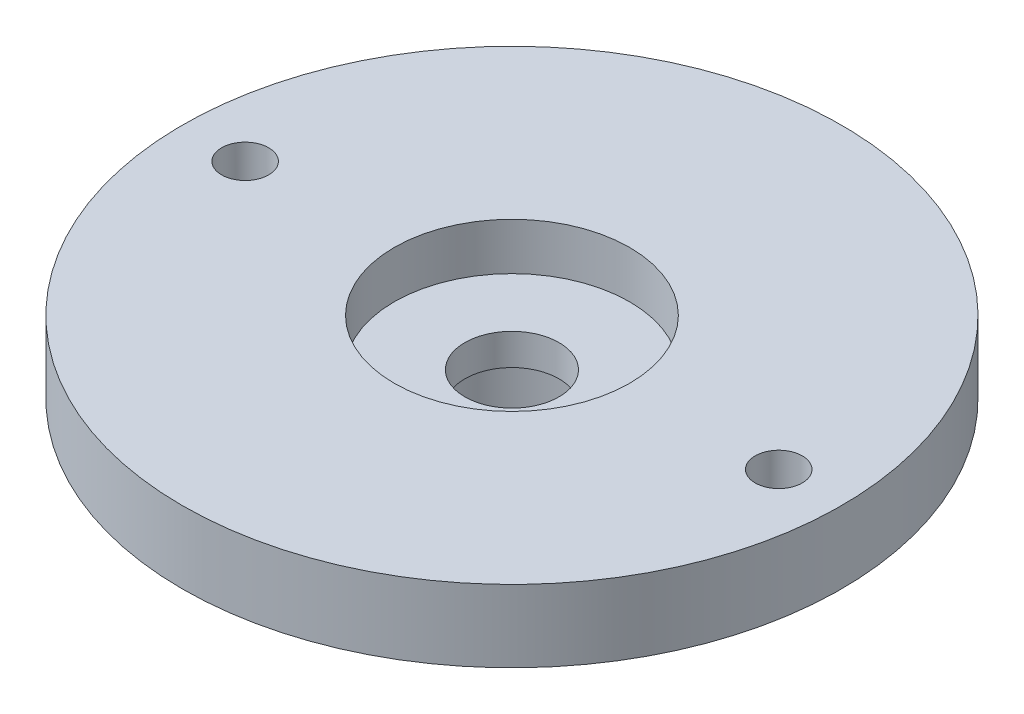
SolidWorks part; units mm, degrees
ref_plane "Přední" through (0, 0, 0) normal (0, 0, 1) x (1, 0, 0)
ref_plane "Horní" through (0, 0, 0) normal (0, 1, 0) x (1, 0, 0)
ref_plane "Pravá" through (0, 0, 0) normal (1, 0, 0) x (0, 0, -1)
sketch "Skica1" plane through (0, 0, 0) normal (0, 0, 1) x (1, 0, 0)
  line L0 (0, 9.5609) -> (0, -3.8281) construction
  line L1 (3, 0) -> (4.5, 0)
  line L2 (4.5, 0) -> (4.5, 3.2)
  line L3 (4.5, 3.2) -> (10.5, 3.2)
  line L4 (10.5, 3.2) -> (10.5, 5.5)
  line L5 (10.5, 5.5) -> (3.75, 5.5)
  line L6 (3.75, 5.5) -> (3.75, 4)
  line L9 (3.75, 4) -> (1.5, 4)
  line L10 (1.5, 4) -> (1.5, 3)
  line L11 (1.5, 3) -> (3, 3)
  line L12 (3, 3) -> (3, 0)
  dimension "D1" = 3
  dimension "D2" = 6
  dimension "D3" = 1.5
  dimension "D4" = 9
  dimension "D5" = 7.5
  dimension "D6" = 21
  dimension "D7" = 2.3
  dimension "D10" = 5.5
  dimension "D11" = 3
revolve "Základ-Rotační" add sketch "Skica1" angle 360 about L0
sketch "Skica2" plane through (0, 5.5, 0) normal (0, 1, 0) x (-1, 0, 0)
  line L0 (-10.5955, 0) -> (10.9916, 0) construction
  line L1 (0, -10.1252) -> (0, 9.0359) construction
  circle A0 centre (-8.5, 0) radius 0.75
  circle A1 centre (8.5, 0) radius 0.75
  dimension "D1" = 17
  dimension "D2" = 1.5
extrude "Odebrat vysunutím1" cut sketch "Skica2" against normal through all
